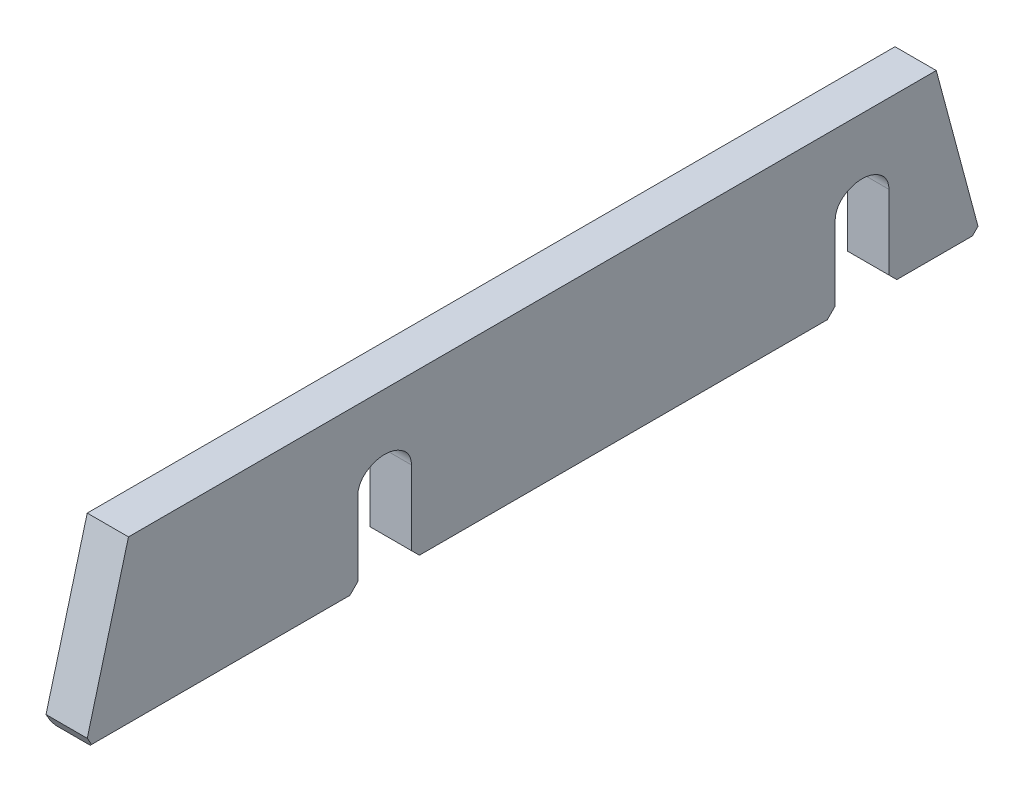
SolidWorks part; units mm, degrees
ref_plane "Front Plane" through (0, 0, 0) normal (1, 0, 0) x (0, 1, 0)
ref_plane "Top Plane" through (0, 0, 0) normal (0, 0, 1) x (0, 1, 0)
ref_plane "Right Plane" through (0, 0, 0) normal (0, 1, 0) x (-1, 0, 0)
sketch "Sketch2" plane through (0, 0, 0) normal (1, 0, 0) x (0, 1, 0)
  line L7 (-405.4975, 1989.725) -> (405.4975, 1989.725)
  line L8 (-405.4975, 1989.725) -> (-405.4975, -1989.725)
  line L9 (-405.4975, -1989.725) -> (405.4975, -1989.725)
  line L10 (405.4975, 1989.725) -> (405.4975, -1989.725)
  line L11 (-405.4975, 1989.725) -> (405.4975, -1989.725) construction
  line L12 (-405.4975, -1989.725) -> (405.4975, 1989.725) construction
  point P0 (0, 0)
  dimension "D1" = 810.995
  dimension "D2" = 3979.45
extrude "Boss-Extrude1" add sketch "Sketch2" along normal mid plane 203.2
sketch "Sketch4" plane through (0, 0, 0) normal (1, 0, 0) x (0, 1, 0)
  line L1 (15.3247, -1491.8985) -> (-405.4975, -1491.8985)
  line L3 (-405.4975, -1491.8985) -> (-405.4975, -1756.4625)
  line L8 (-405.4975, -1756.4625) -> (15.3247, -1756.4625)
  line L9 (-405.4975, 860.1015) -> (15.3247, 860.1015)
  line L10 (-405.4975, 595.5375) -> (15.3247, 595.5375)
  line L11 (-405.4975, 860.1015) -> (-405.4975, 595.5375)
  line L12 (-405.4975, -1989.725) -> (405.4975, -1989.725) construction
  line L13 (405.4975, 1989.725) -> (-405.4975, 1989.725) construction
  line L14 (-405.4975, 25.2765) -> (15.3247, 25.2765) construction
  line L15 (-405.4975, 25.2765) -> (-405.4975, -239.2875) construction
  line L16 (-405.4975, -239.2875) -> (15.3247, -239.2875) construction
  line L17 (-405.4975, 1989.725) -> (-405.4975, -1989.725) construction
  arc A4 (93.8403, 822.0313) -> (93.8403, 633.6077) centre (-25.603, 727.8195) cw
  arc A5 (93.8403, -1529.9687) -> (93.8403, -1718.3923) centre (-25.603, -1624.1805) cw
  arc A6 (93.8403, -12.7937) -> (93.8403, -201.2173) centre (-25.603, -107.0055) cw construction
  arc A7 (93.8403, -1718.3923) -> (15.3247, -1756.4625) centre (15.3247, -1656.4625) cw
  arc A8 (93.8403, -1529.9687) -> (15.3247, -1491.8985) centre (15.3247, -1591.8985) ccw
  arc A9 (15.3247, -239.2875) -> (93.8403, -201.2173) centre (15.3247, -139.2875) ccw construction
  arc A10 (15.3247, 25.2765) -> (93.8403, -12.7937) centre (15.3247, -74.7235) cw construction
  arc A11 (15.3247, 595.5375) -> (93.8403, 633.6077) centre (15.3247, 695.5375) ccw
  arc A12 (15.3247, 860.1015) -> (93.8403, 822.0313) centre (15.3247, 760.1015) cw
  point P12 (126.5238, -107.0055)
  point P21 (126.5238, 727.8195)
  point P26 (49.5238, -1756.4625)
  point P29 (49.5238, -1491.8985)
  point P32 (49.5238, -239.2875)
  point P35 (49.5238, 25.2765)
  point P38 (49.5238, 595.5375)
  point P41 (49.5238, 860.1015)
  point P42 (126.5238, -1624.1805)
  dimension "D1" = 233.2625
  dimension "D8" = 100
  dimension "D2" = 497.8265
  dimension "D3" = 1394.1875
  dimension "D4" = 1129.6235
  dimension "D5" = 2015.0015
  dimension "D6" = 1750.4375
  dimension "D7" = 455.0213
  dimension "D9" = 77
extrude "Cut-Extrude2" cut sketch "Sketch4" against normal through all both and the other way through all
sketch "Sketch5" plane through (0, 0, 0) normal (1, 0, 0) x (0, 1, 0)
  line L0 (405.4975, 1989.725) -> (-405.4975, 2207.0305)
  line L1 (-405.4975, 2207.0305) -> (-405.4975, 1989.725)
  line L2 (-405.4975, 1989.725) -> (405.4975, 1989.725)
  line L3 (405.4975, -1989.725) -> (-405.4975, -2207.0305)
  line L4 (-405.4975, -2207.0305) -> (-405.4975, -1989.725)
  line L5 (-405.4975, -1989.725) -> (405.4975, -1989.725)
  dimension "D1" = 15
  dimension "D2" = 15
extrude "Boss-Extrude2" add sketch "Sketch5" along normal mid plane 203.2
chamfer "Chamfer2" distance 16 angle 45 6 edges at (101.6, -405.4975, 1533.566) (-101.6, -405.4975, -448.1805) (-101.6, -405.4975, -1981.7465) (101.6, -405.4975, -448.1805) (101.6, -405.4975, -1981.7465) (-101.6, -405.4975, 1533.566)
chamfer "Chamfer3" distance 55 angle 45 18 edges at (0, -405.4975, -2207.0305) (-93.6, -397.4975, -2204.8869) (93.6, -397.4975, -2204.8869) (0, -405.4975, -1756.4625) (-93.6, -397.4975, -1756.4625) (93.6, -397.4975, -1756.4625) (0, -405.4975, -1491.8985) (-93.6, -397.4975, -1491.8985) (93.6, -397.4975, -1491.8985) (0, -405.4975, 595.5375) (-93.6, -397.4975, 595.5375) (93.6, -397.4975, 595.5375) (0, -405.4975, 860.1015) (-93.6, -397.4975, 860.1015) (93.6, -397.4975, 860.1015) (0, -405.4975, 2207.0305) (-93.6, -397.4975, 2204.8869) (93.6, -397.4975, 2204.8869)
